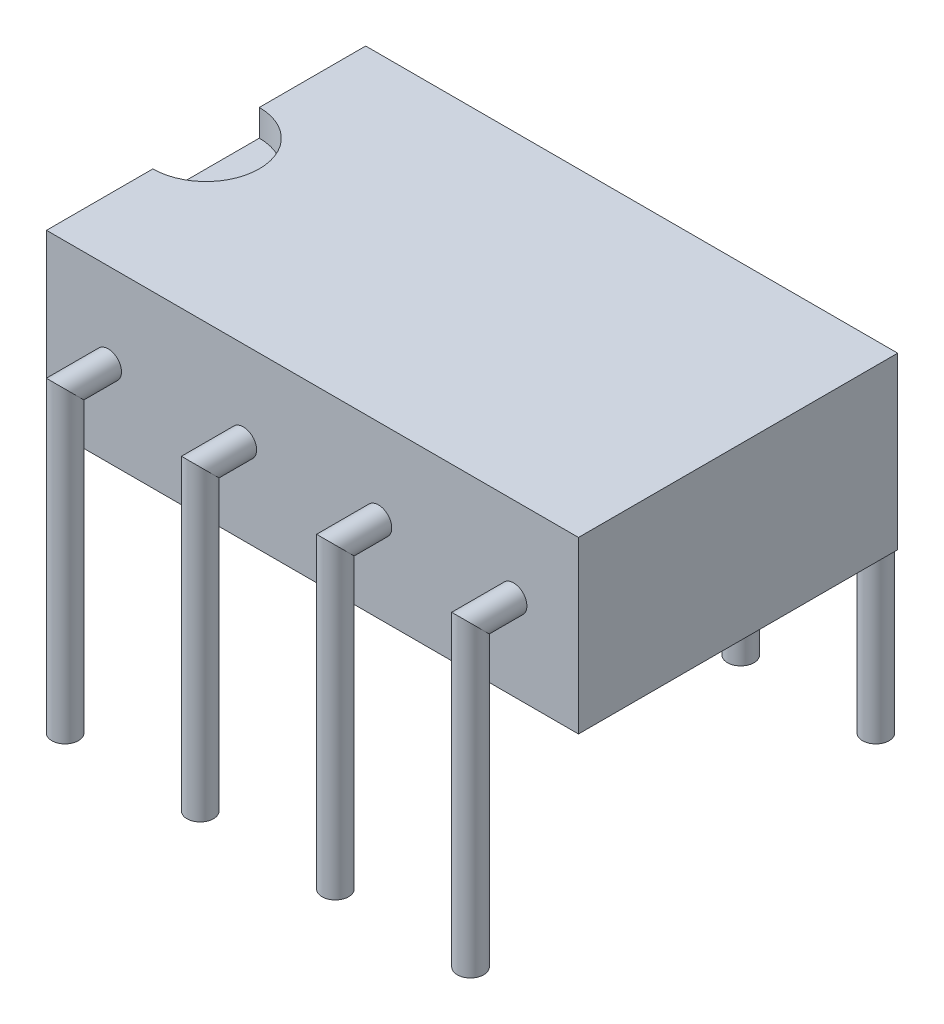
SolidWorks part; units mm, degrees
ref_plane "Plan de face" through (0, 0, 0) normal (0, 0, 1) x (1, 0, 0)
ref_plane "Plan de dessus" through (0, 0, 0) normal (0, 1, 0) x (1, 0, 0)
ref_plane "Plan de droite" through (0, 0, 0) normal (1, 0, 0) x (0, 0, -1)
sketch "Esquisse1" plane through (0, 0, 0) normal (1, 0, 0) x (0, 0, -1)
  line L0 (-34.0084, 0) -> (28.7946, 0) construction
  line L1 (0, -15.76) -> (0, 25.9507) construction
  line L2 (-13.1897, 3.2) -> (13.1184, 3.2) construction
  line L3 (3, 10.112) -> (3, -6.1718) construction
  line L4 (-3, 10.112) -> (-3, -4.99) construction
  line L6 (-3, 3.2) -> (3, 3.2)
  line L7 (-3, 3.2) -> (-3, 0)
  line L8 (-3, 0) -> (3, 0)
  line L9 (3, 3.2) -> (3, 0)
  dimension "D1" = 3
  dimension "D2" = 6
  dimension "D3" = 3.2
extrude "Extrusion1" add sketch "Esquisse1" along normal blind 10
sketch "Esquisse2" plane through (0, 3.2, 0) normal (0, 1, 0) x (-1, 0, 0)
  line L0 (0, -1) -> (0, 1)
  arc A0 (0, 1) -> (0, -1) centre (0, 0) ccw
extrude "Enlèv. mat.-Extru.1" cut sketch "Esquisse2" against normal blind 0.5
sketch "Esquisse3" plane through (0, 0, 3) normal (0, 0, 1) x (1, 0, 0)
  line L0 (-0.9705, 0) -> (10.7632, 0) construction
  line L1 (0, 4.319) -> (0, -1.0907) construction
  line L2 (-0.7349, 1.6) -> (2.3847, 1.6) construction
  line L3 (1.16, 2.698) -> (1.16, -1.0907) construction
  circle A0 centre (1.16, 1.6) radius 0.25
  dimension "D1" = 1.6
  dimension "D2" = 1.16
ref_plane "Plan1" through (1.16, 0, 0) normal (1, 0, 0) x (0, 0, -1)
sketch "Esquisse5" plane through (1.16, 0, 0) normal (1, 0, 0) x (0, 0, -1)
  line L0 (-5.4746, 0) -> (4.976, 0) construction
  line L1 (-3, -1.7147) -> (-3, 5.2592) construction
  line L2 (-4.2866, -4) -> (4.976, -4) construction
  line L3 (-3.81, -4.4343) -> (-3.81, 4.8284) construction
  line L4 (-5.4746, 1.6) -> (-3, 1.6) construction
  line L5 (-3, 1.6) -> (-3.81, 1.6)
  line L6 (-3.81, 1.6) -> (-3.81, -4)
  dimension "D1" = 4
  dimension "D2" = 0.81
sweep "Balayage1" add profiles "Esquisse3" path "Esquisse5"
ref_plane "Plan2" through (0, 0, 0) normal (0, 0, 1) x (1, 0, 0)
mirror "Symétrie1" about plane through (0, 0, 0) normal (0, 0, 1) of "Balayage1"
pattern_linear "Répétition linéaire1" count 4 spacing 2.54 along (1, 0, 0) of "Balayage1", "Symétrie1"
